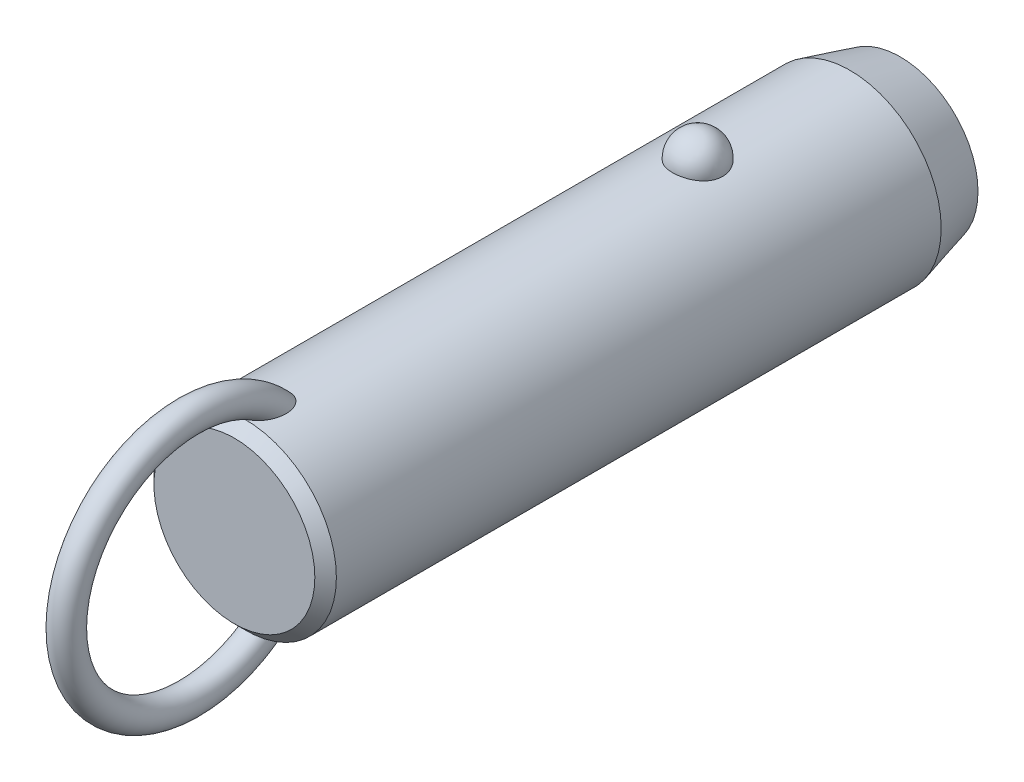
SolidWorks part; units mm, degrees
ref_plane "Front Plane" through (0, 0, 0) normal (0, 0, 1) x (1, 0, 0)
ref_plane "Top Plane" through (0, 0, 0) normal (0, 1, 0) x (1, 0, 0)
ref_plane "Right Plane" through (0, 0, 0) normal (1, 0, 0) x (0, 0, -1)
sketch "Sketch2" plane through (0, 0, 0) normal (0, 0, 1) x (1, 0, 0)
  circle A0 centre (0, 0) radius 12.7
  point P3 (0, 12.7)
  dimension "D1" = 25.4
extrude "Boss-Extrude1" add sketch "Sketch2" along normal blind 48.3
sketch "Sketch3" plane through (0, 0, 0) normal (0, 0, -1) x (-1, 0, 0)
  circle A0 centre (0, 0) radius 12.7
  dimension "D1" = 25.4
extrude "Boss-Extrude2" add sketch "Sketch3" along normal blind 31.7
chamfer "Chamfer1" distance 7 angle 15 1 edges at (-12.7, 0, -31.7)
sketch "Sketch12" plane through (0, 0, 0) normal (1, 0, 0) x (0, 0, -1)
  line L0 (-48.3, 12.7) -> (-48.3, -12.7) construction
  point P0 (-48.3, 0)
sketch "Sketch13" plane through (0, 0, 0) normal (1, 0, 0) x (0, 0, -1)
  circle A0 centre (-67.35, 0) radius 19.05
  point P2 (-48.3, 0)
  dimension "D1" = 38.1
sketch "Sketch14" plane through (0, 0, 0) normal (0, 1, 0) x (1, 0, 0)
  circle A0 centre (0, -50.3) radius 2
  point P2 (0, -48.3)
  dimension "D1" = 4
sweep "Sweep1" add profiles "Sketch14" path "Sketch13"
sketch "Sketch15" plane through (0, 0, 48.3) normal (0, 0, 1) x (1, 0, 0)
  circle A0 centre (0, 0) radius 12.7
  dimension "D1" = 25.4
extrude "Boss-Extrude3" add sketch "Sketch15" along normal blind 12.7
chamfer "Chamfer2" distance 1.5 angle 45 1 edges at (12.7, 0, 61)
sketch "Sketch18" plane through (0, 0, 0) normal (1, 0, 0) x (0, 0, -1)
  line L0 (24.7, 12.7) -> (-53.151, 12.7) construction
  line L1 (3.5, 16.2) -> (3.5, 9.2)
  line L2 (-53.151, -12.7) -> (24.7, -12.7) construction
  arc A0 (3.5, 16.2) -> (3.5, 9.2) centre (3.5, 12.7) ccw
  point P4 (0, 12.7)
  dimension "D1" = 28.9
revolve "Revolve1" add sketch "Sketch18" angle 360 about L1
